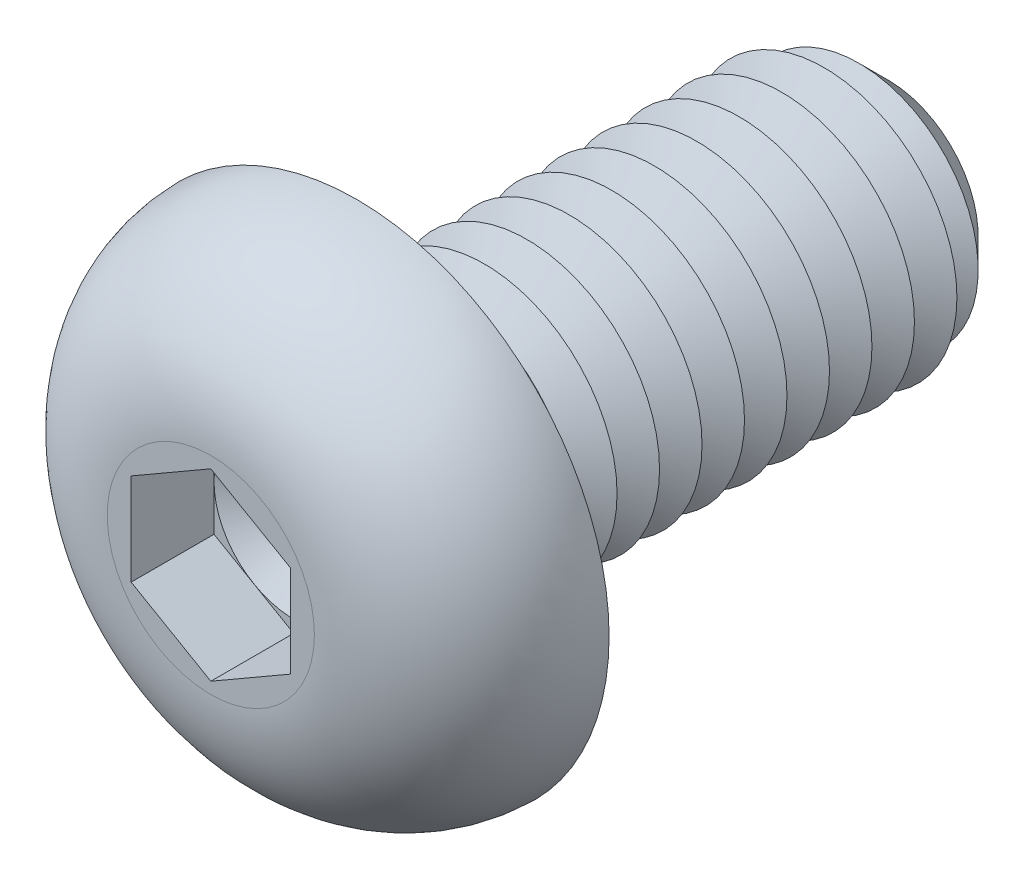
SolidWorks part; units mm, degrees
ref_plane "Front Plane" through (0, 0, 0) normal (0, 0, 1) x (1, 0, 0)
ref_plane "Top Plane" through (0, 0, 0) normal (0, 1, 0) x (1, 0, 0)
ref_plane "Right Plane" through (0, 0, 0) normal (1, 0, 0) x (0, 0, -1)
sketch "Sketch1" plane through (0, 0, 0) normal (1, 0, 0) x (0, 0, -1)
  line L0 (-47.9342, 0) -> (60.3146, 0) construction
sketch "Sketch2" plane through (0, 0, 0) normal (1, 0, 0) x (0, 0, -1)
  line L0 (0, 0) -> (-2.75, 0)
  line L1 (-47.9342, 0) -> (60.3146, 0) construction
  line L2 (-2.75, 0) -> (-2.75, 1.9504)
  line L3 (0, 4.75) -> (0, 0)
  arc A0 (-2.75, 1.9504) -> (0, 4.75) centre (0.05, 1.9504) cw
  dimension "D1" = 2.8
  dimension "D2" = 2.75
  dimension "D3" = 4.75
revolve "Revolve1" add sketch "Sketch2" angle 360 about L0
sketch "Sketch3" plane through (0, 0, 2.75) normal (0, 0, 1) x (1, 0, 0)
  line L1 (0, 1.7321) -> (-1.5, 0.866)
  line L2 (-1.5, 0.866) -> (-1.5, -0.866)
  line L3 (-1.5, -0.866) -> (0, -1.7321)
  line L4 (0, -1.7321) -> (1.5, -0.866)
  line L5 (1.5, -0.866) -> (1.5, 0.866)
  line L6 (1.5, 0.866) -> (0, 1.7321)
  circle A0 centre (0, 0) radius 1.5 construction
  dimension "D1" = 3
extrude "Cut-Extrude1" cut sketch "Sketch3" against normal blind 1.56
sketch "Sketch4" plane through (0, 0, 0) normal (0, 0, -1) x (-1, 0, 0)
  circle A0 centre (0, 0) radius 2.5
  dimension "D1" = 5
extrude "Boss-Extrude1" add sketch "Sketch4" along normal blind 10
chamfer "Chamfer1" distance 0.8 angle 45 1 edges at (-2.5, 0, -10)
sketch "Sketch5" plane through (0, 0, 0) normal (1, 0, 0) x (0, 0, -1)
  line L0 (0.8, 2.5) -> (1.6, 2.5)
  line L1 (9.2, 2.5) -> (0, 2.5) construction
  line L2 (1.6, 2.5) -> (1.2, 1.8072)
  line L3 (1.2, 1.8072) -> (0.8, 2.5)
  line L4 (0, -4.75) -> (0, 4.75) construction
  line L5 (9.2, 2.5) -> (0, 2.5) construction
  dimension "D1" = 0.8
  dimension "D2" = 0.8
revolve "Cut-Revolve1" cut sketch "Sketch5" angle 360 about L0
pattern_linear "LPattern1" count 11 spacing 0.8 along (0, 0, -1) of "Cut-Revolve1"
fillet "Fillet2" radius 0.4 1 edges at (2.5, 0, 0)
sketch "Sketch6" plane through (0, 0, 1.19) normal (0, 0, 1) x (1, 0, 0)
  line L0 (0, -1.7321) -> (1.5, -0.866) construction
  circle A0 centre (0, 0) radius 1.5
extrude "Cut-Extrude2" cut sketch "Sketch6" against normal through all draft 60
